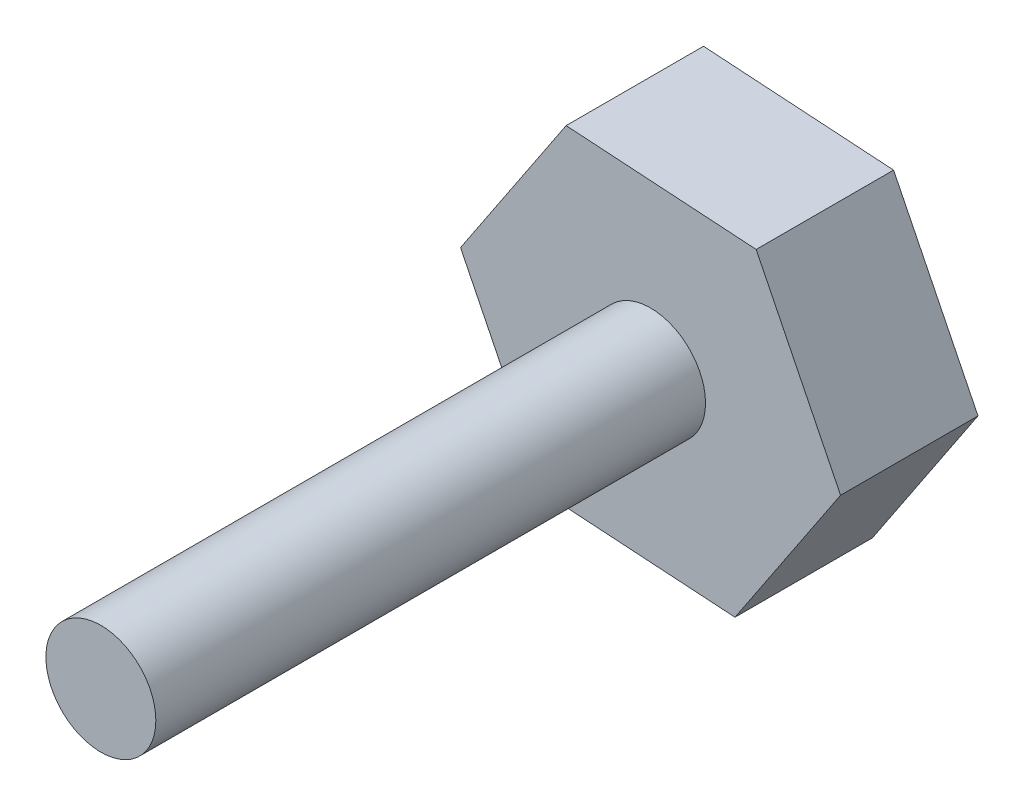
SolidWorks part; units mm, degrees
ref_plane "Front Plane" through (0, 0, 0) normal (0, 0, 1) x (1, 0, 0)
ref_plane "Top Plane" through (0, 0, 0) normal (0, 1, 0) x (1, 0, 0)
ref_plane "Right Plane" through (0, 0, 0) normal (1, 0, 0) x (0, 0, -1)
sketch "Sketch1" plane through (0, 0, 0) normal (0, 0, 1) x (1, 0, 0)
  line L1 (3.901, -7.8868) -> (8.7807, -0.565)
  line L2 (8.7807, -0.565) -> (4.8797, 7.3218)
  line L3 (4.8797, 7.3218) -> (-3.901, 7.8868)
  line L4 (-3.901, 7.8868) -> (-8.7807, 0.565)
  line L5 (-8.7807, 0.565) -> (-4.8797, -7.3218)
  line L6 (-4.8797, -7.3218) -> (3.901, -7.8868)
  circle A0 centre (0, 0) radius 7.62 construction
extrude "Boss-Extrude1" add sketch "Sketch1" along normal blind 6.35
sketch "Sketch2" plane through (0, 0, 6.35) normal (0, 0, 1) x (1, 0, 0)
  circle A0 centre (0, 0) radius 2.54
extrude "Boss-Extrude2" add sketch "Sketch2" along normal blind 25.4
